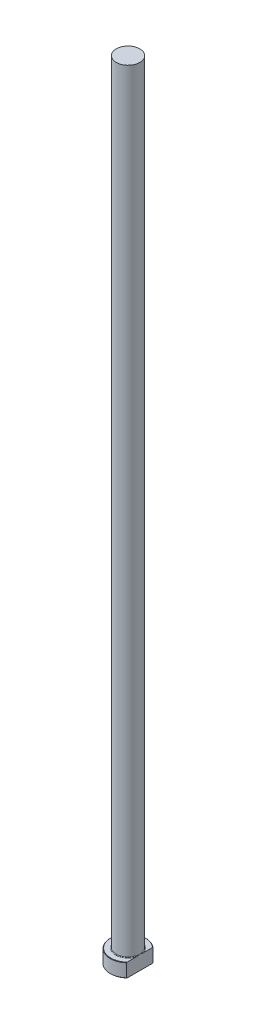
SolidWorks part; units mm, degrees
ref_plane "Front Plane" through (0, 0, 0) normal (0, 0, 1) x (1, 0, 0)
ref_plane "Top Plane" through (0, 0, 0) normal (0, 1, 0) x (1, 0, 0)
ref_plane "Right Plane" through (0, 0, 0) normal (1, 0, 0) x (0, 0, -1)
sketch "Sketch1" plane through (0, 0, 0) normal (0, 0, 1) x (1, 0, 0)
  line L0 (0, 259.9588) -> (0, -15.1925) construction
  line L1 (0, 0) -> (-9, 0)
  line L2 (-9, 0) -> (-9, 7)
  line L3 (-9, 7) -> (-6, 7)
  line L4 (-6, 7) -> (-6, 400)
  line L5 (-6, 400) -> (0, 400)
  line L6 (0, 400) -> (0, 0)
  dimension "L" = 400
  dimension "H" = 18
  dimension "T" = 7
  dimension "D" = 12
revolve "Revolve1" add sketch "Sketch1" angle 360 about L0
chamfer "Chamfer1" distance 0.2 angle 45 2 edges at (0, 7, 9) (0, 0, 9)
fillet "Fillet1" radius 0.3 1 edges at (0, 7, 6)
sketch "Sketch2" plane through (0, 0, 0) normal (0, 1, 0) x (1, 0, 0)
  line L0 (6, 6.7082) -> (6, -6.7082)
  circle A0 centre (0, 0) radius 9 construction
  arc A1 (6, -6.7082) -> (6, 6.7082) centre (0, 0) ccw
  circle A2 centre (0, 0) radius 6 construction
extrude "KEY" cut sketch "Sketch2" along normal through all
